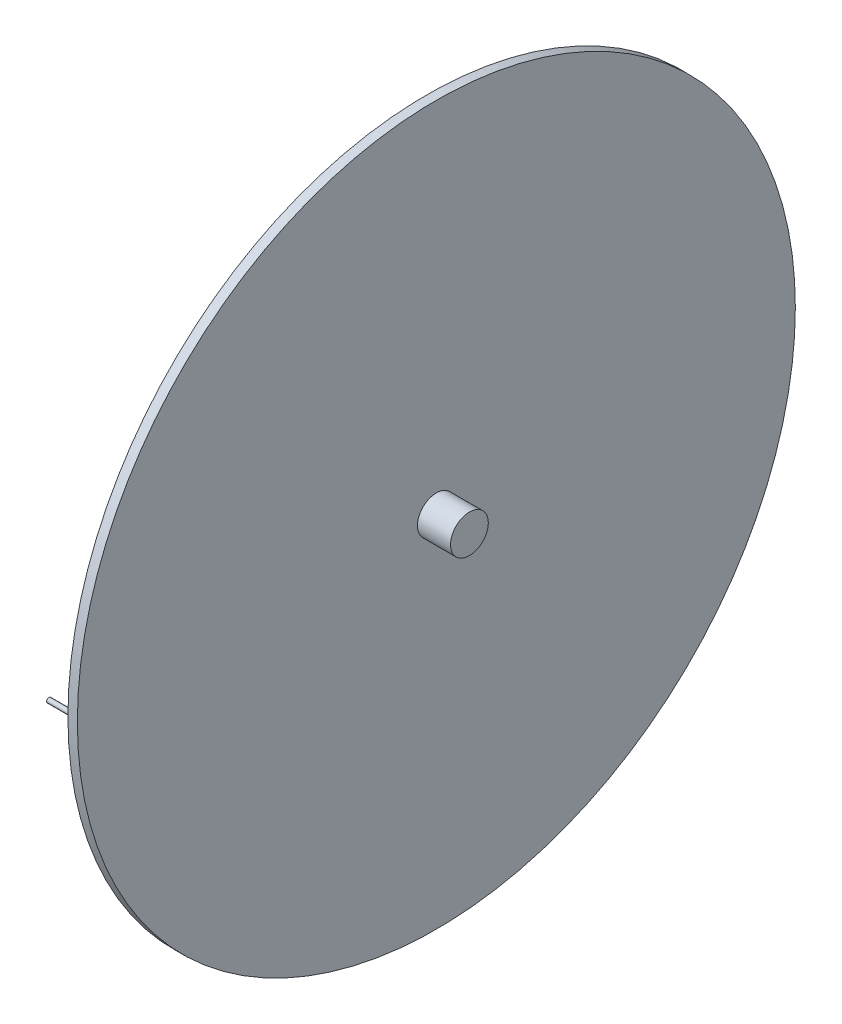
SolidWorks part; units mm, degrees
ref_plane "Front Plane" through (0, 0, 0) normal (0, 0, 1) x (1, 0, 0)
ref_plane "Top Plane" through (0, 0, 0) normal (0, 1, 0) x (1, 0, 0)
ref_plane "Right Plane" through (0, 0, 0) normal (1, 0, 0) x (0, 0, -1)
sketch "Sketch1" plane through (0, 0, 0) normal (1, 0, 0) x (0, 0, -1)
  circle A0 centre (0, 0) radius 380
extrude "Boss-Extrude2" add sketch "Sketch1" along normal blind 10 contours A0
sketch "Sketch2" plane through (10, 0, 0) normal (1, 0, 0) x (0, 0, -1)
  circle A0 centre (0, 0) radius 20
extrude "Boss-Extrude3" add sketch "Sketch2" along normal blind 35
sketch "Sketch3" plane through (0, 0, 0) normal (-1, 0, 0) x (0, 0, 1)
  line L0 (0, 0) -> (375, 0) construction
  circle A1 centre (375, 0) radius 2.5
extrude "Boss-Extrude4" add sketch "Sketch3" along normal blind 25
